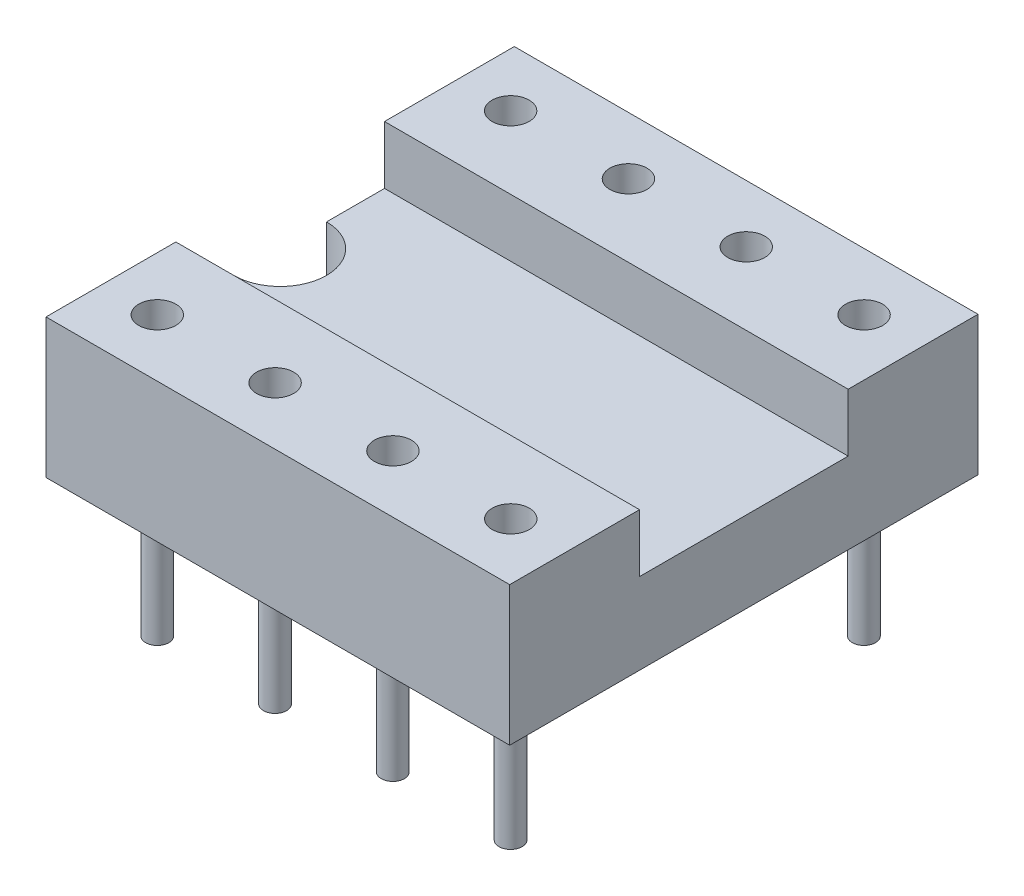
SolidWorks part; units mm, degrees
ref_plane "Plan de face" through (0, 0, 0) normal (0, 0, 1) x (1, 0, 0)
ref_plane "Plan de dessus" through (0, 0, 0) normal (0, 1, 0) x (1, 0, 0)
ref_plane "Plan de droite" through (0, 0, 0) normal (1, 0, 0) x (0, 0, -1)
sketch "Esquisse1" plane through (0, 0, 0) normal (1, 0, 0) x (0, 0, -1)
  line L0 (12.2051, 0) -> (-23.3437, 0) construction
  line L1 (0, -4.6214) -> (0, 25.9507) construction
  line L2 (-5.7968, 1.75) -> (2.763, 1.75) construction
  line L3 (5.7565, 3) -> (-6.8307, 3) construction
  line L4 (5.05, 3.8077) -> (5.05, -1.0493) construction
  line L5 (-5.05, 3.7235) -> (-5.05, -1.0493) construction
  line L6 (-2.25, 3.5071) -> (-2.25, 0.8142) construction
  line L7 (2.25, 3.5071) -> (2.25, 0.8142) construction
  line L8 (-2.25, 1.75) -> (-2.25, 3)
  line L9 (-2.25, 3) -> (-5.05, 3)
  line L10 (-5.05, 3) -> (-5.05, 0)
  line L11 (-5.05, 0) -> (5.05, 0)
  line L12 (5.05, 0) -> (5.05, 3)
  line L13 (5.05, 3) -> (2.25, 3)
  line L14 (2.25, 3) -> (2.25, 1.75)
  line L15 (2.25, 1.75) -> (-2.25, 1.75)
  dimension "D1" = 1.75
  dimension "D2" = 3
  dimension "D3" = 5.05
  dimension "D4" = 5.05
  dimension "D5" = 2.8
  dimension "D6" = 2.8
extrude "Extrusion1" add sketch "Esquisse1" along normal blind 10
sketch "Esquisse2" plane through (0, 1.75, 0) normal (0, 1, 0) x (-1, 0, 0)
  line L0 (0, -1) -> (0, 1)
  arc A0 (0, 1) -> (0, -1) centre (0, 0) ccw
extrude "Enlèv. mat.-Extru.1" cut sketch "Esquisse2" against normal through all
sketch "Esquisse3" plane through (0, 3, 0) normal (0, 1, 0) x (-1, 0, 0)
  line L0 (-13.1576, 5.05) -> (2.3638, 5.05) construction
  line L1 (0, 6.1465) -> (0, -6.3771) construction
  line L2 (1.5124, 0) -> (-12.9979, 0) construction
  line L3 (1.0512, 3.81) -> (-15.6055, 3.81) construction
  line L4 (-1.16, 6.2884) -> (-1.16, 1.7827) construction
  circle A0 centre (-1.16, 3.81) radius 0.4
  circle A1 centre (-1.16, -3.81) radius 0.4
  circle A2 centre (-3.701, 3.81) radius 0.4
  circle A3 centre (-3.701, -3.81) radius 0.4
  circle A4 centre (-6.242, 3.81) radius 0.4
  circle A5 centre (-6.242, -3.81) radius 0.4
  circle A6 centre (-8.783, 3.81) radius 0.4
  circle A7 centre (-8.783, -3.81) radius 0.4
  dimension "D3" = 4
  dimension "D1" = 1.24
  dimension "D2" = 1.16
extrude "Enlèv. mat.-Extru.2" cut sketch "Esquisse3" against normal blind 2.5
sketch "Esquisse5" plane through (0, 0, 0) normal (0, -1, 0) x (1, 0, 0)
  line L0 (-0.4263, 0) -> (10.6481, 0) construction
  line L1 (10.6481, -3.81) -> (-0.9108, -3.81) construction
  line L2 (10.6481, 3.81) -> (-0.9108, 3.81) construction
  circle A0 centre (1.16, 3.81) radius 0.25
  circle A1 centre (1.16, -3.81) radius 0.25
  circle A2 centre (3.7, -3.81) radius 0.25
  circle A3 centre (3.7, 3.81) radius 0.25
  circle A4 centre (6.24, -3.81) radius 0.25
  circle A5 centre (6.24, 3.81) radius 0.25
  circle A6 centre (8.78, -3.81) radius 0.25
  circle A7 centre (8.78, 3.81) radius 0.25
  dimension "D1" = 4
  dimension "D2" = 3.81
extrude "Extrusion2" add sketch "Esquisse5" along normal blind 3
